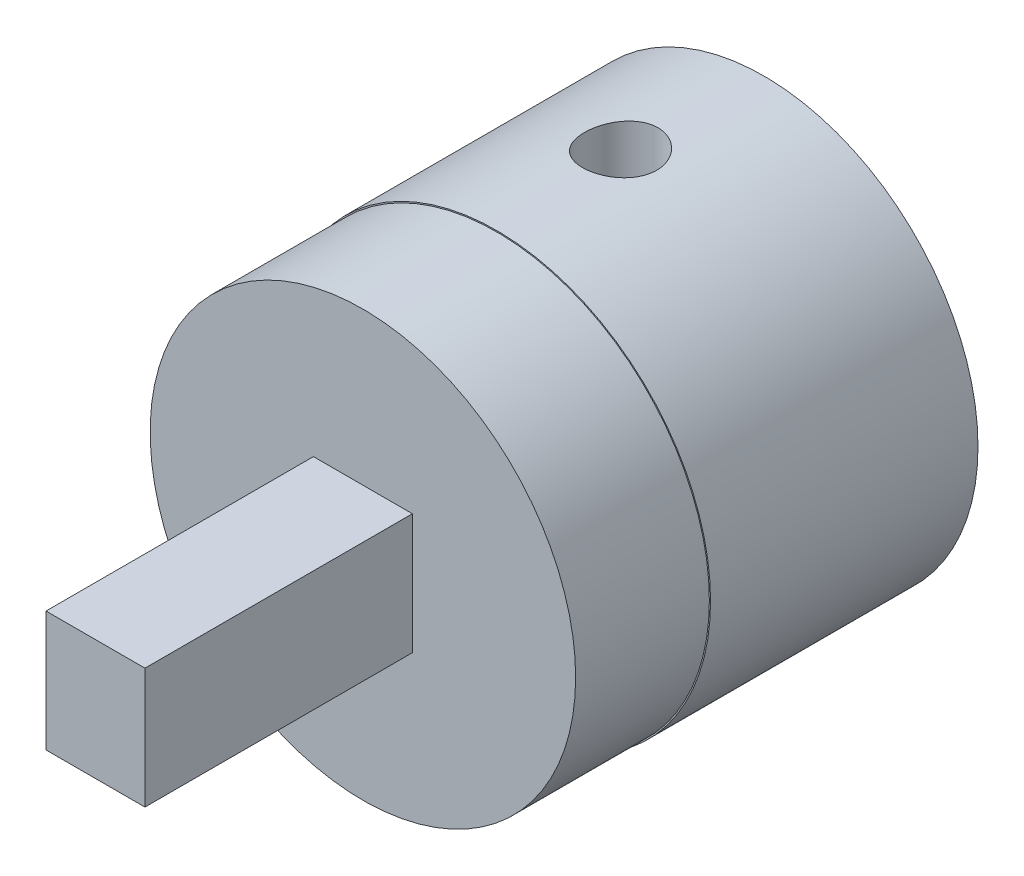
SolidWorks part; units mm, degrees
ref_plane "Front Plane" through (0, 0, 0) normal (0, 0, 1) x (1, 0, 0)
ref_plane "Top Plane" through (0, 0, 0) normal (0, 1, 0) x (1, 0, 0)
ref_plane "Right Plane" through (0, 0, 0) normal (1, 0, 0) x (0, 0, -1)
sketch "Sketch2" plane through (0, 0, 0) normal (0, 0, 1) x (1, 0, 0)
  line L0 (-4.7613, -2.0947) -> (-4.7613, -7.0947) construction
  line L1 (-4.7613, 3.9053) -> (-4.7613, 8.9053) construction
  circle A0 centre (-4.7613, 0.9053) radius 3
  circle A1 centre (-4.7613, 0.9053) radius 8
  dimension "D1" = 6
  dimension "D2" = 5
  dimension "D3" = 5
extrude "Boss-Extrude1" add sketch "Sketch2" along normal blind 10
sketch "Sketch3" plane through (0, 0, 10) normal (0, 0, 1) x (1, 0, 0)
  circle A2 centre (-4.7613, 0.9053) radius 7.955
sketch "Sketch5" plane through (0, 0, 10) normal (0, 0, 1) x (1, 0, 0)
  circle A0 centre (-4.7613, 0.9053) radius 7.955
extrude "Boss-Extrude3" add sketch "Sketch5" along normal blind 5
sketch "Sketch6" plane through (0, 0, 15) normal (0, 0, 1) x (1, 0, 0)
  line L0 (-4.7613, 8.8603) -> (-4.7613, -7.0497) construction
  line L1 (-4.7613, -7.0497) -> (-4.7613, 0.9053) construction
  line L2 (-4.7613, 0.9053) -> (3.1937, 0.9053) construction
  line L3 (3.1937, 0.9053) -> (-12.7163, 0.9053) construction
  line L5 (-6.6113, 3.1553) -> (-2.9113, 3.1553)
  line L6 (-6.6113, 3.1553) -> (-6.6113, -1.3447)
  line L7 (-6.6113, -1.3447) -> (-2.9113, -1.3447)
  line L8 (-2.9113, 3.1553) -> (-2.9113, -1.3447)
  line L9 (-6.6113, 3.1553) -> (-2.9113, -1.3447) construction
  line L10 (-6.6113, -1.3447) -> (-2.9113, 3.1553) construction
  circle A0 centre (-4.7613, 0.9053) radius 7.955 construction
  dimension "D1" = 3.7
  dimension "D2" = 4.5
extrude "Boss-Extrude4" add sketch "Sketch6" along normal blind 10
sketch "Sketch8" plane through (0, 0, 0) normal (0, 1, 0) x (1, 0, 0)
  line L0 (-5.1273, 0) -> (-5.1273, -10) construction
  line L1 (-12.7163, -10) -> (3.1937, -10) construction
  line L2 (-5.1273, -5) -> (3.2387, -5) construction
  line L3 (3.2387, -10) -> (3.2387, 0) construction
  line L4 (3.2387, -5) -> (-12.7613, -5) construction
  line L5 (-12.7613, 0) -> (-12.7613, -10) construction
  circle A0 centre (-5.1273, -5) radius 1.35
  dimension "D1" = 2.7
extrude "Cut-Extrude1" cut sketch "Sketch8" along normal blind 11 and the other way blind 12
